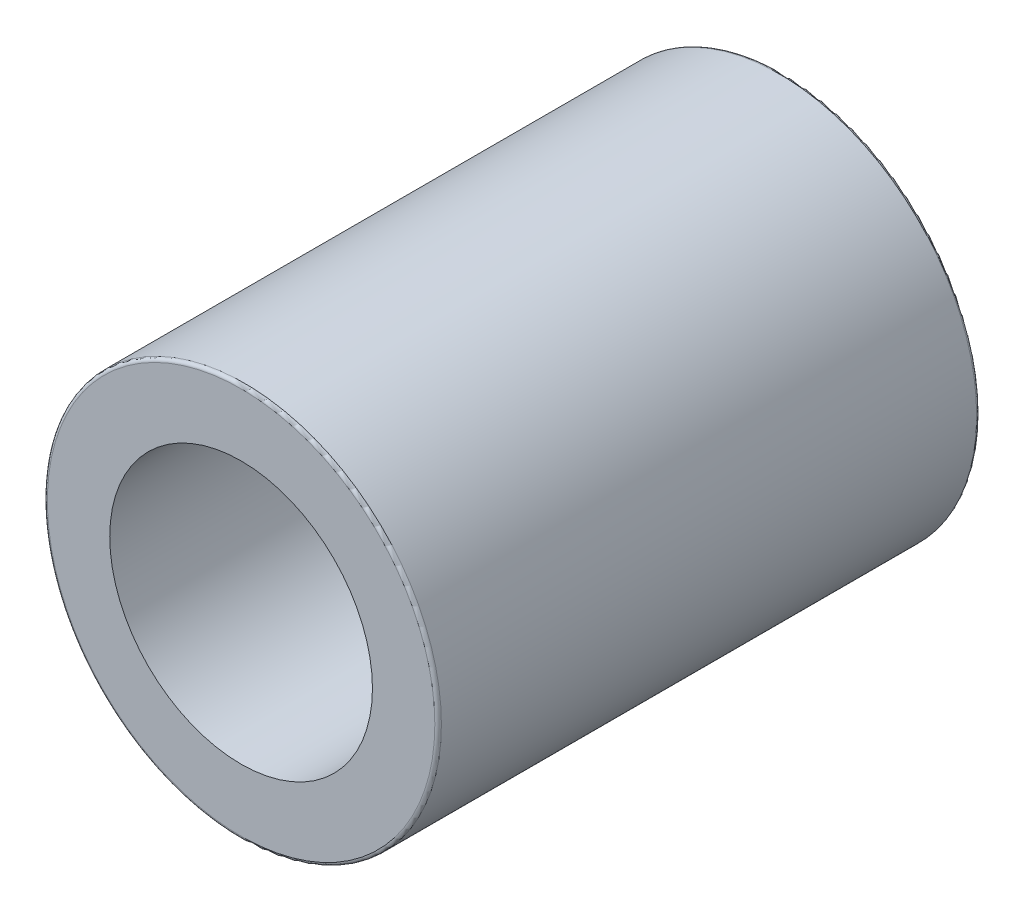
SolidWorks part; units mm, degrees
ref_plane "Front Plane" through (0, 0, 0) normal (0, 0, 1) x (1, 0, 0)
ref_plane "Top Plane" through (0, 0, 0) normal (0, 1, 0) x (1, 0, 0)
ref_plane "Right Plane" through (0, 0, 0) normal (1, 0, 0) x (0, 0, -1)
sketch "Sketch1" plane through (0, 0, 0) normal (0, 0, 1) x (1, 0, 0)
  circle A0 centre (0, 0) radius 60
  circle A1 centre (0, 0) radius 40
  dimension "D1" = 120
  dimension "D2" = 80
extrude "Boss-Extrude1" add sketch "Sketch1" along normal blind 165
fillet "Fillet1" radius 1 2 edges at (60, 0, 0) (60, 0, 165)
